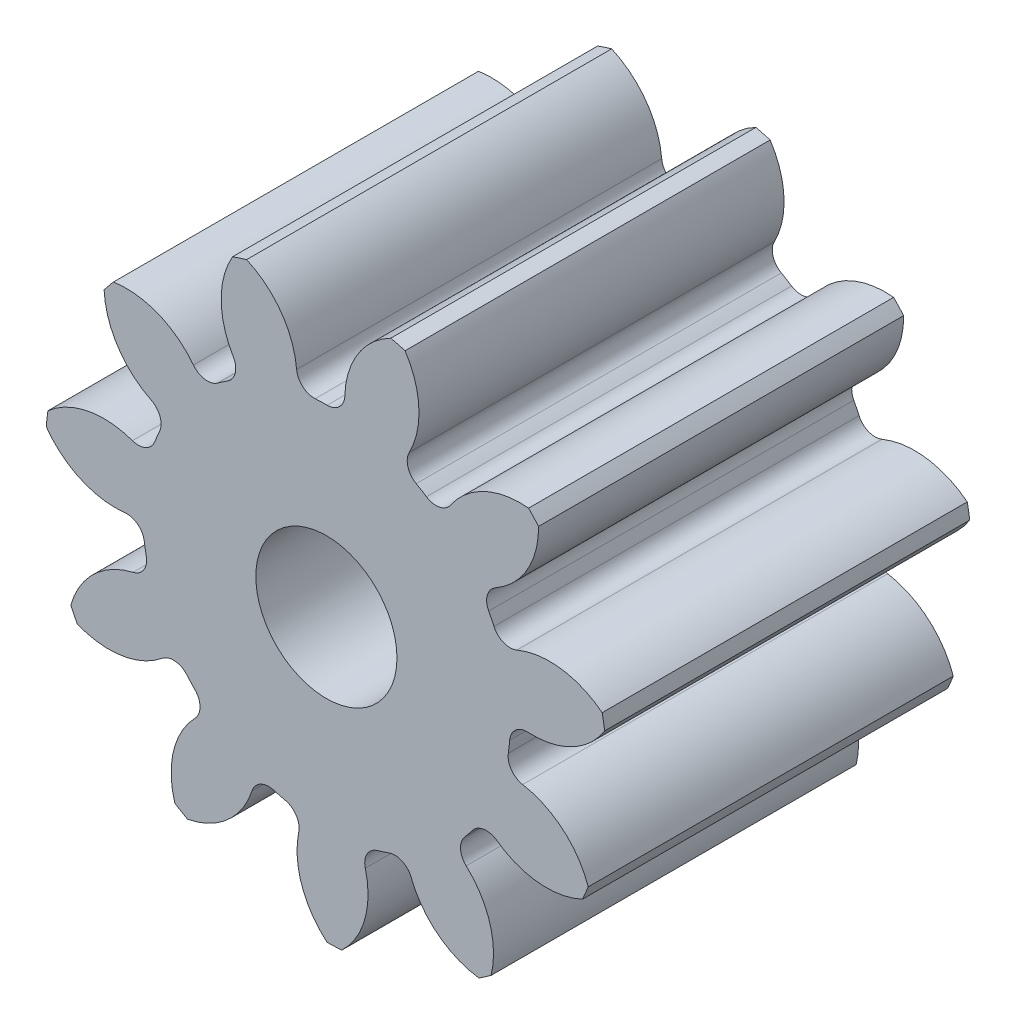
SolidWorks part; units mm, degrees
ref_plane "Front" through (0, 0, 0) normal (0, 0, 1) x (1, 0, 0)
ref_plane "Top" through (0, 0, 0) normal (0, 1, 0) x (1, 0, 0)
ref_plane "Right" through (0, 0, 0) normal (1, 0, 0) x (0, 0, -1)
sketch "Sketch3" plane through (0, 0, 0) normal (0, 0, 1) x (1, 0, 0)
  circle A0 centre (0, 0) radius 73.3778
  dimension "od" = 146.7556
extrude "gearBody" add sketch "Sketch3" along normal blind 95.25
sketch "Sketch2" plane through (0, 0, 0) normal (0, 0, 1) x (1, 0, 0)
  line L0 (0, 0) -> (53.9033, 22.3275) construction
  line L1 (68.7555, -28.2665) -> (0, 0) construction
  line L2 (0, 0) -> (36.3143, 0) construction
  line L3 (62.0626, 1.8076) -> (60.0312, -15.8521) construction
  line L5 (61.0469, -7.0223) -> (0, 0) construction
  line L7 (0, 0) -> (58.3445, 0) construction
  arc A0 (58.3403, 0.6953) -> (56.6587, -13.9237) centre (0, 0) ccw construction
  arc A1 (72.6093, 10.5919) -> (68.3079, -26.8017) centre (0, 0) ccw construction
  arc A2 (62.0626, 1.8076) -> (60.0312, -15.8521) centre (0, 0) ccw construction
  arc A3 (47.4601, -7.0291) -> (47.8165, -3.9306) centre (0, 0) ccw
  arc A4 (68.7555, -28.2665) -> (51.2164, -12.2286) centre (47.4258, -33.9834) ccw
  arc A5 (68.7555, -28.2665) -> (73.3778, 11.9167) centre (0, 0) ccw
  arc A6 (73.3778, 11.9167) -> (52.6553, 0.2802) centre (53.9033, 22.3275) cw
  arc A7 (47.8165, -3.9306) -> (52.6553, 0.2802) centre (52.3956, -4.307) cw
  arc A8 (51.2164, -12.2286) -> (47.4601, -7.0291) centre (52.0051, -7.7023) cw
  point P6 (73.3778, 11.9167)
  point P22 (68.7555, -28.2665)
  dimension "baseDia" = 116.6889
  dimension "od" = 146.7556
  dimension "pd" = 124.1778
  dimension "rd" = 95.9556
  dimension "rFillet" = 4.5946
  dimension "pointX" = 73.3778
  dimension "pointY" = 11.9167
  dimension "CTT" = 17.6597
  dimension "flankCenterAngle" = 22.5
extrude "toothCut" cut sketch "Sketch2" along normal through all
pattern_circular "CirPattern1" count 11 over 360 about axis through (0, 0, 0) along (0, 0, 1) of "toothCut"
sketch "hub1Dia" plane through (0, 0, 0) normal (0, 0, -1) x (-1, 0, 0)
  circle A0 centre (0, 0) radius 12.7
  dimension "hub1Dia" = 25.4
sketch "hub2Dia" plane through (0, 0, 95.25) normal (0, 0, 1) x (1, 0, 0)
  circle A0 centre (0, 0) radius 12.7
  dimension "hub2dia" = 25.4
sketch "boreDia" plane through (0, 0, 0) normal (0, 0, 1) x (1, 0, 0)
  circle A0 centre (0, 0) radius 18.415
  dimension "boreDia" = 36.83
extrude "bore" cut sketch "boreDia" against normal mid plane 25400
